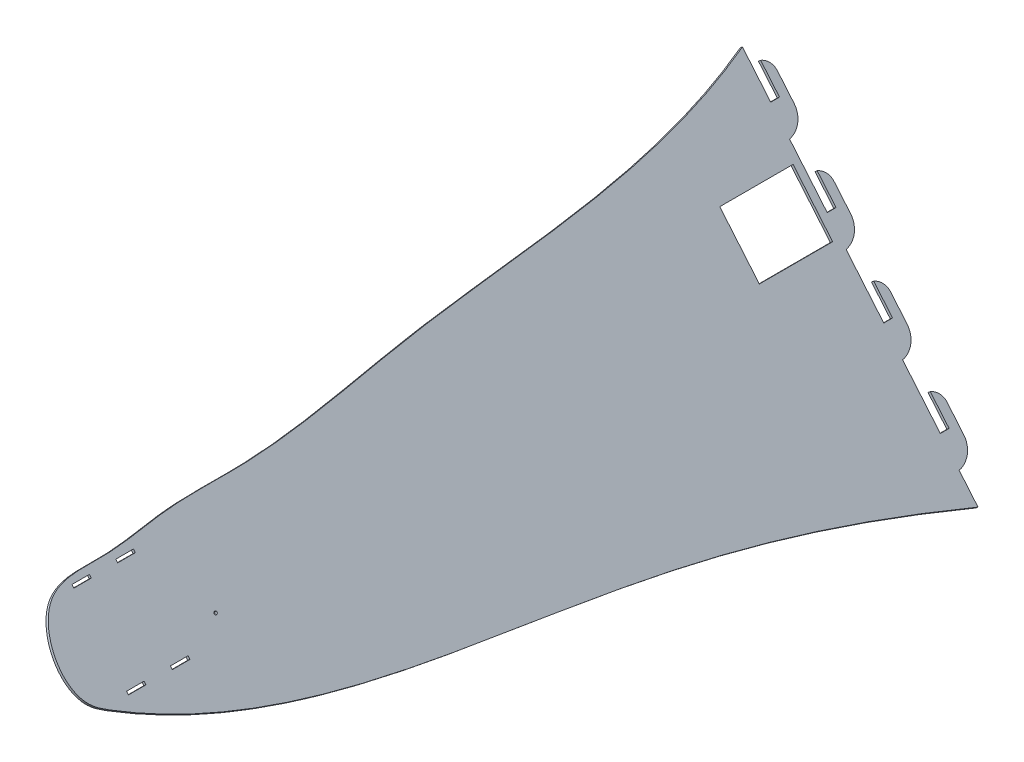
SolidWorks part; units mm, degrees
ref_plane "Front Plane" through (0, 0, 0) normal (0, 0, 1) x (1, 0, 0)
ref_plane "Top Plane" through (0, 0, 0) normal (0, 1, 0) x (1, 0, 0)
ref_plane "Right Plane" through (0, 0, 0) normal (1, 0, 0) x (0, 0, -1)
sketch "Sketch1" plane through (0, 0, 0) normal (0, 0, 1) x (1, 0, 0)
  line L0 (-63.4955, 109.8969) -> (97.2014, -81.6142)
  line L1 (167.9818, -167.5227) -> (-204.3374, 276.1901) construction
  line L2 (161.4192, 135.4468) -> (-161.4192, -135.4468) construction
  line L3 (167.9818, -167.5227) -> (-204.3374, 276.1901) construction
  line L4 (-65.0276, 108.6113) -> (95.6693, -82.8998)
  line L5 (95.6693, -82.8998) -> (97.2014, -81.6142)
  line L6 (-65.0276, 108.6113) -> (-63.4955, 109.8969)
  point P4 (16.853, 14.1413)
  dimension "D1" = 250
  dimension "D2" = 1
extrude "Boss-Extrude1" add sketch "Sketch1" along normal blind 550
sketch "Sketch4" plane through (16.853, 14.1413, 0) normal (0.766, 0.6428, 0) x (0, 0, -1)
  circle A0 centre (-525.1358, -87.7857) radius 17.3719
extrude "Cut-Extrude1" cut sketch "Sketch4" against normal blind 550
sketch "Sketch5" plane through (16.853, 14.1413, 0) normal (0.766, 0.6428, 0) x (0, 0, -1)
  line L1 (-502.9427, -110.69) -> (-492.9672, -110.69)
  line L2 (-502.9427, -110.69) -> (-502.9427, -101.7899)
  line L3 (-502.9427, -101.7899) -> (-492.9672, -101.7899)
  line L4 (-492.9672, -110.69) -> (-492.9672, -101.7899)
extrude "Cut-Extrude2" cut sketch "Sketch5" against normal blind 550
sketch "Sketch6" plane through (16.853, 14.1413, 0) normal (0.766, 0.6428, 0) x (0, 0, -1)
  line L0 (1744.6479, -990.4911) -> (1744.6479, -830.4911) construction
  line L2 (-492.9672, -101.7899) -> (-502.9427, -101.7899) construction
  spline S0 degree 3 poles (0, -125) (-122.6021, -80.6023) (-261.4866, -68.2897) (-449.0563, -39.9957) (-533.0243, 13.5438) (-524.3786, 70.2181) (-470.6837, 64.0663) (-426.3946, 72.1574) (-351.6861, 68.7087) (-209.7356, 94.4827) (-81.8631, 93.2027) (0, 125) knots 0 0 0 0 0.267493 0.474445 0.484207 0.531876 0.569159 0.61065 0.657525 0.768364 1 1 1 1
  dimension "D1" = 19.2231
  dimension "D2" = 65.1139
  dimension "D3" = 117.1467
  dimension "D4" = 199.4846
  dimension "D5" = 239.5068
  dimension "D6" = 329.4583
  dimension "D7" = 343.9624
  dimension "D8" = 2237.6151
  dimension "D9" = 18.6858
  dimension "D10" = 21.5461
  dimension "D11" = 27.3394
  dimension "D12" = 21.6122
  dimension "D13" = 39.9701
  dimension "D14" = 101.7899
  dimension "D15" = 108.3142
  dimension "D16" = 160.9158
  dimension "D17" = 168.0557
  dimension "D18" = 172.0089
  dimension "D19" = 172.7694
  dimension "D20" = 185.7675
  dimension "D21" = 195.6096
extrude "Cut-Extrude3" cut sketch "Sketch6" against normal through all and the other way through all contours S0
sketch "Sketch8" plane through (16.853, 14.1413, 0) normal (0.766, 0.6428, 0) x (0, 0, -1)
  line L0 (12, -91.1436) -> (12, -73.4853)
  line L1 (0, -125) -> (0, 125) construction
  line L2 (6, -85) -> (6, -65)
  line L3 (6, -85) -> (0, -85)
  line L5 (0, -125) -> (0, 125)
  line L6 (0, -105) -> (0, -85)
  arc A0 (12, -91.1436) -> (0, -105) centre (-2, -91.1436) cw
  arc A1 (12, -73.4853) -> (6, -65) centre (3, -73.4853) ccw
  spline S1 degree 3 poles (386.5527, 1047.2371) (267.9226, 46.3403) (-41.628, 125.006) (-351.6861, 68.7087) (-426.3946, 72.1574) (-470.6837, 64.0663) (-524.3786, 70.2181) (-533.0243, 13.5438) (-449.0563, -39.9957) (-122.3704, -89.2746) (61.924, -90.4123) (875.0813, -608.8522) knots -0.461096 -0.461096 -0.461096 -0.461096 0.231636 0.342475 0.38935 0.430841 0.468124 0.515793 0.525555 0.732507 1.359125 1.359125 1.359125 1.359125 only from (0, 125) to (0, -125)
extrude "Boss-Extrude2" add sketch "Sketch8" against normal up to surface (2 mm away)
pattern_linear "LPattern1" count 4 spacing 60 along (-0.6428, 0.766, 0) of "Boss-Extrude2"
other "Cavity1"
other "dorsalFinTop<1>@BodyWindVoices1"
other "dorsalFinTop<6>@BodyWindVoices1"
sketch "Sketch9" plane through (15.3209, 12.8558, 0) normal (-0.766, -0.6428, 0) x (0, 0, 1)
  line L0 (0, 15) -> (0, -25) construction
  line L1 (486, 1.9194) -> (498, 1.9194) construction
  circle A0 centre (430, 15.2242) radius 1
  dimension "D1" = 2
  dimension "D2" = 430
  dimension "D3" = 13.3047
extrude "Cut-Extrude4" cut sketch "Sketch9" against normal up to surface (2 mm away)
sketch "Sketch10" plane through (15.3209, 12.8558, 0) normal (-0.766, -0.6428, 0) x (0, 0, 1)
  line L0 (0, 210.7178) -> (0, -210.7178) construction
  line L1 (55, 63.5) -> (5, 63.5)
  line L2 (55, 63.5) -> (55, 21.5)
  line L3 (55, 21.5) -> (5, 21.5)
  line L4 (5, 63.5) -> (5, 21.5)
  dimension "D1" = 5
  dimension "D2" = 50
  dimension "D3" = 42
  dimension "D4" = 61.5
extrude "Cut-Extrude5" cut sketch "Sketch10" against normal up to surface (2 mm away)
equation "\"thick\"=6"
equation "\"D1@Sketch8\"=\"thick\""
